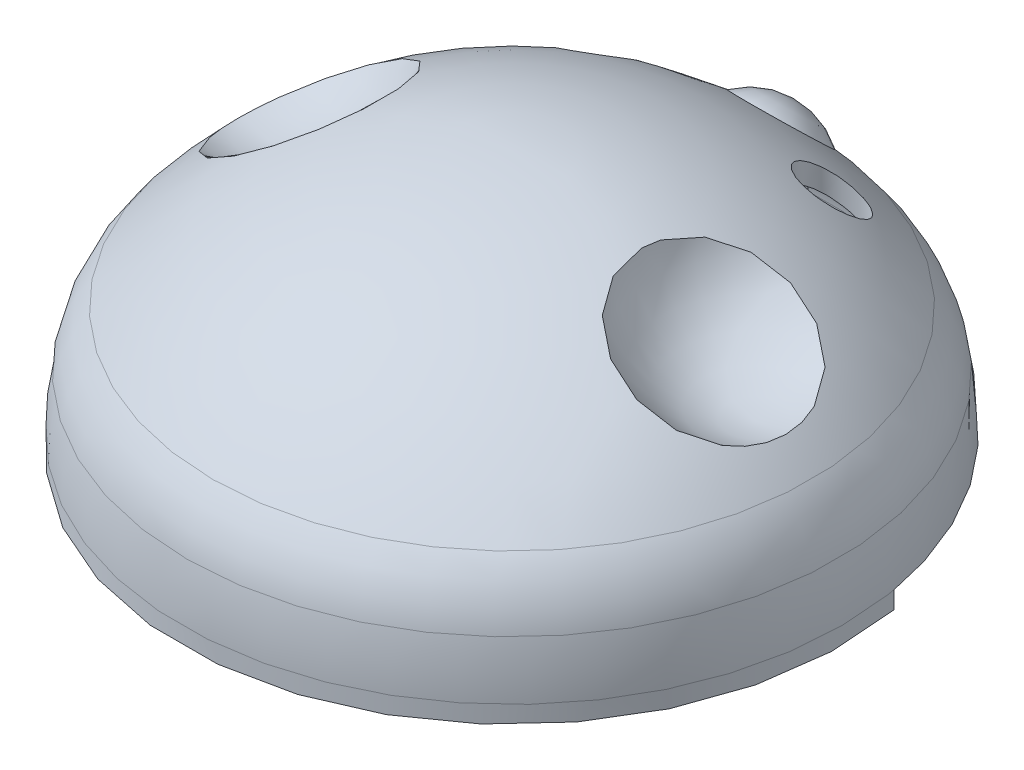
SolidWorks part; units mm, degrees
ref_plane "Plan de face" through (0, 0, 0) normal (0, 0, 1) x (1, 0, 0)
ref_plane "Plan de dessus" through (0, 0, 0) normal (0, 1, 0) x (1, 0, 0)
ref_plane "Plan de droite" through (0, 0, 0) normal (1, 0, 0) x (0, 0, -1)
sketch "Esquisse1" plane through (0, 0, 0) normal (0, 0, 1) x (1, 0, 0)
  line L0 (0, 0) -> (0, 21.5) construction
  line L1 (0, 0) -> (-28.5, 0) construction
  line L2 (-28.5, 21.5) -> (0, 21.5) construction
  line L3 (-28.5, 21.5) -> (-28.5, 0) construction
  arc A0 (0, 21.5) -> (-25.8378, 9.6) centre (0, -12.5) ccw
  arc A1 (-28.5, 0) -> (-28.097, 4.7757) centre (0, 0) cw
  arc A2 (-25.8378, 9.6) -> (-28.097, 4.7757) centre (-18.2384, 3.1) ccw
  point P4 (0, -12.5)
  dimension "D2" = 28.5
  dimension "D3" = 34
  dimension "D4" = 10
  dimension "D1" = 12.5
  dimension "D5" = 21.5
  dimension "D6" = 28.5
revolve "Révol.-Mince1" add sketch "Esquisse1" angle 360 about L0
sketch "Esquisse2" plane through (0, 0, 0) normal (1, 0, 0) x (0, 0, -1)
  line L0 (20.4736, 14.6447) -> (26.0252, 9.379) construction
  line L1 (23.2494, 12.0118) -> (24.2816, 13.1001) construction
  line L2 (20.4736, 14.6447) -> (23.2494, 12.0118)
  line L3 (23.2494, 12.0118) -> (24.2816, 13.1001)
  arc A0 (20.4736, 14.6447) -> (24.2816, 13.1001) centre (20.4079, 9.0161) cw
  arc A1 (25.8378, 9.6) -> (-25.8378, 9.6) centre (0, -12.5) ccw construction
  dimension "D1" = 9.7
  dimension "D2" = 16.7
  dimension "D3" = 1.5
revolve "Révolution2" add sketch "Esquisse2" angle 360 about L3
sketch "Esquisse3" plane through (0, 0, 0) normal (0, 1, 0) x (1, 0, 0)
  line L0 (-10.15, 17.5) -> (10.15, 17.5) construction
  line L1 (0, 0) -> (0, 28.5) construction
  line L2 (0, 28.5) -> (10.15, 28.5) construction
  circle A0 centre (-10.15, 17.5) radius 2.5
  circle A1 centre (10.15, 17.5) radius 2.5
  circle A2 centre (0, 0) radius 28.5 construction
  dimension "D1" = 5
  dimension "D2" = 5
  dimension "D3" = 20.3
  dimension "D4" = 10.15
  dimension "D5" = 11
extrude "Enlèv. mat.-Extru.1" cut sketch "Esquisse3" along normal through all
sketch "Esquisse8" plane through (0, 0, 0) normal (0, 0, 1) x (1, 0, 0)
  line L0 (-21, 10.8906) -> (-20.6, 0)
  line L1 (-28.5, 0) -> (28.5, 0) construction
  line L2 (-20.6, 0) -> (-19.4, 0)
  line L3 (-17.5, 0) -> (-17.5, 27.0708) construction
  line L4 (-19.4, 0) -> (-19.4, 20.9215)
  line L5 (-21, 10.8906) -> (-21, 20.9215)
  line L6 (-21, 20.9215) -> (-19.4, 20.9215)
  point P7 (0, 0)
  dimension "D1" = 17.5
  dimension "D2" = 3.5
  dimension "D3" = 3.1
  dimension "D4" = 1.9
revolve "Révolution7" add sketch "Esquisse8" angle 360 about L3
mirror "Symétrie7" about plane through (0, 0, 0) normal (1, 0, 0) of "Révolution7"
sketch "Esquisse4" plane through (0, 0, 0) normal (0, 0, 1) x (1, 0, 0)
  line L0 (-28.5, 0) -> (28.5, 0) construction
  line L1 (-21, 21.5399) -> (21, 21.5399) construction
  line L2 (-21, 31.5399) -> (-21, 11.5399)
  arc A0 (-21, 31.5399) -> (-21, 11.5399) centre (-21, 21.5399) ccw
  point P2 (0, 0)
  dimension "D2" = 20
  dimension "D1" = 21
  dimension "D3" = 42
revolve "Révolution6" add sketch "Esquisse4" angle 360 about L2
pattern_linear "Répétition linéaire1" count 2 spacing 42 along (1, 0, 0)
other "Embouti3" parameters "D1"=1.5, "D2"=0
sketch "Esquisse5" plane through (0, 0, 0) normal (1, 0, 0) x (0, 0, -1)
  line L0 (20, 14.0422) -> (20, 8)
  line L1 (20, 8) -> (22.5, 8)
  line L2 (22.5, 8) -> (22.5, 6)
  line L3 (-28.5, 0) -> (28.5, 0) construction
  line L4 (22.5, 6) -> (25, 6)
  line L5 (25, 6) -> (25, 9.3132)
  line L6 (20, 14.0422) -> (25, 9.3132)
  dimension "D1" = 8.5
  dimension "D2" = 2.5
  dimension "D3" = 2.5
  dimension "D4" = 2
  dimension "D5" = 6
extrude "Extrusion1" add sketch "Esquisse5" along normal mid plane 1.2
ref_plane "Plan1" through (7.25, 0, 0) normal (1, 0, 0) x (0, 0, -1)
sketch "Esquisse6" plane through (7.25, 0, 0) normal (1, 0, 0) x (0, 0, -1)
  line L0 (-22.5, 10.879) -> (-22.5, 2)
  line L1 (-22.5, 2) -> (-26.9682, 2)
  line L2 (-28.5, 0) -> (28.5, 0) construction
  line L3 (-22.5, 10.879) -> (-25.9964, 6.464)
  line L4 (-25.9964, 6.464) -> (-26.9682, 2)
  dimension "D1" = 6
  dimension "D2" = 2
extrude "Extrusion2" add sketch "Esquisse6" along normal mid plane 1.5
mirror "Symétrie5" about plane through (0, 0, 0) normal (1, 0, 0) of "Extrusion2"
ref_plane "Plan2" through (0, 0, 18) normal (0, 0, 1) x (1, 0, 0)
sketch "Esquisse7" plane through (0, 0, 18) normal (0, 0, 1) x (1, 0, 0)
  line L0 (20.1114, 6) -> (12.5, 6)
  line L1 (12.5, 6) -> (12.5, 8)
  line L2 (12.5, 8) -> (8.5, 8)
  line L3 (8.5, 8) -> (8.5, 14.1818)
  line L4 (8.5, 14.1818) -> (13.688, 12.0407)
  line L5 (13.688, 12.0407) -> (17.8938, 9.1348)
  line L6 (17.8938, 9.1348) -> (20.1114, 6)
  line L7 (-28.5, 0) -> (28.5, 0) construction
  point P4 (0, 0)
  dimension "D1" = 8.5
  dimension "D2" = 4
  dimension "D3" = 2
  dimension "D4" = 6
extrude "Extrusion3" add sketch "Esquisse7" along normal mid plane 1
mirror "Symétrie6" about plane through (0, 0, 0) normal (1, 0, 0) of "Extrusion3"
sketch "Esquisse10" plane through (0, 0, 0) normal (1, 0, 0) x (0, 0, -1)
  line L0 (5.35, 8) -> (5.75, 20.3172)
  line L2 (5.35, 8) -> (4.4, 8)
  line L3 (4.4, 8) -> (4.4, 20.684)
  line L4 (4.4, 20.684) -> (5.75, 20.3172)
  line L5 (2.5, 0) -> (2.5, 26.0026) construction
  line L6 (-28.5, 0) -> (28.5, 0) construction
  dimension "D1" = 26
  dimension "D2" = 2.85
  dimension "D3" = 1.9
  dimension "D4" = 8
  dimension "D5" = 3.25
revolve "Révolution8" add sketch "Esquisse10" angle 360 about L5
sketch "Esquisse12" plane through (0, 0, 0) normal (1, 0, 0) x (0, 0, -1)
  line L0 (-28.5, 0) -> (28.5, 0) construction
  line L1 (-28.5, 0) -> (-28, 0)
  line L2 (-28.5, 0) -> (-28.5, -1.5)
  line L3 (-28.5, -1.5) -> (-28, -1.5)
  line L4 (-28, 0) -> (-28, -1.5)
  line L5 (0, 0) -> (0, -5.7271) construction
  dimension "D1" = 1.5
  dimension "D2" = 0.5
  dimension "D3" = 28.5
revolve "Révolution9" add sketch "Esquisse12" angle 200 about L5
sketch "Esquisse13" plane through (0, 0, 0) normal (1, 0, 0) x (0, 0, -1)
  line L0 (-28.5, -1.5) -> (4.949, -1.5) construction
  line L1 (-28, -1.5) -> (-27, -1.5)
  line L2 (-28, -1.5) -> (-28, 0)
  line L3 (-28, 0) -> (-27, 0)
  line L4 (-27, -1.5) -> (-27, 0)
  dimension "D1" = 1.5
  dimension "D2" = 1
extrude "Extrusion5" add sketch "Esquisse13" along normal mid plane 0.7
